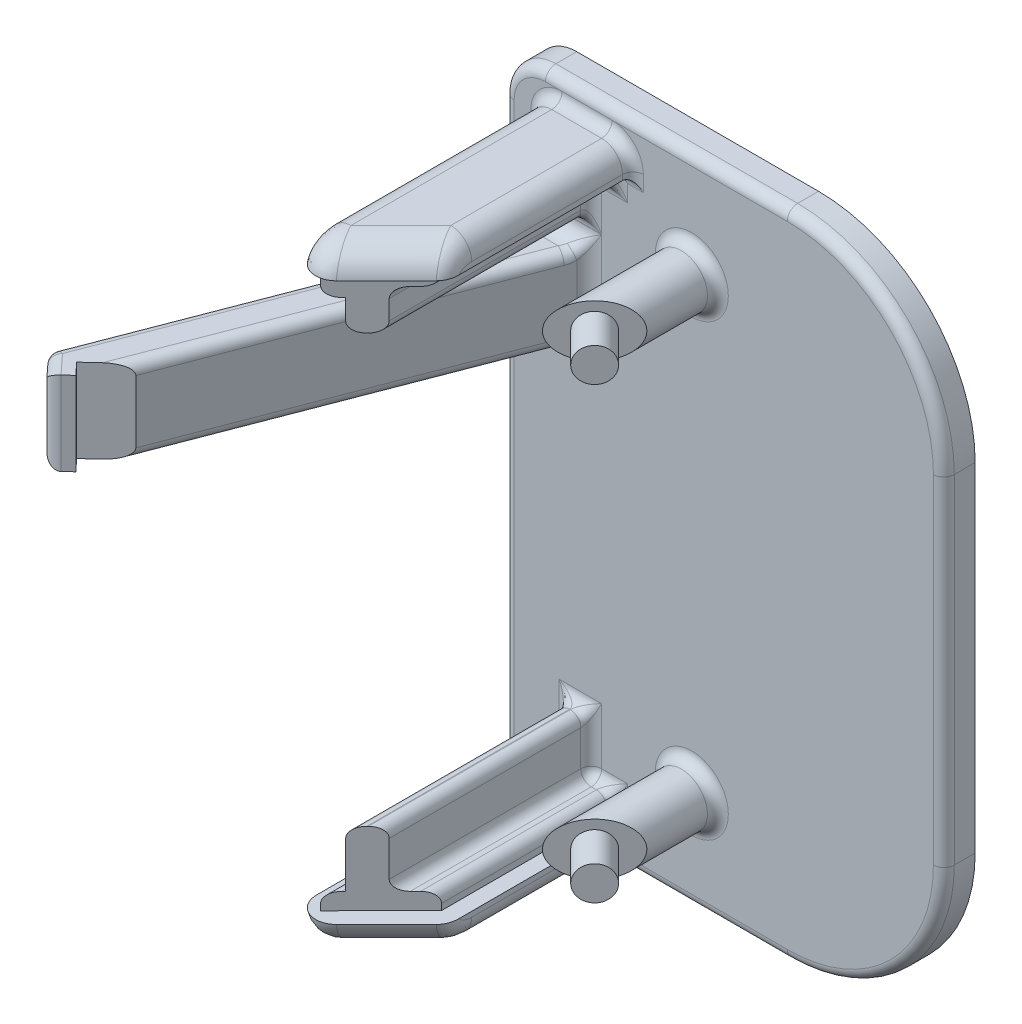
SolidWorks part; units mm, degrees
ref_plane "Front Plane" through (0, 0, 0) normal (0, 0, 1) x (1, 0, 0)
ref_plane "Top Plane" through (0, 0, 0) normal (0, 1, 0) x (1, 0, 0)
ref_plane "Right Plane" through (0, 0, 0) normal (1, 0, 0) x (0, 0, -1)
sketch "Sketch1" plane through (0, 0, 0) normal (0, 0, 1) x (1, 0, 0)
  circle A0 centre (49.5722, 9.7726) radius 2.5
  circle A1 centre (49.5722, 52.7726) radius 2.5
  dimension "D1" = 5
extrude "Boss-Extrude1" add sketch "Sketch1" along normal blind 12
sketch "Sketch2" plane through (0, 5.2784, 0) normal (0, -1, 0) x (1, 0, 0)
  line L1 (26.8033, 32.0723) -> (54.69, 32.0723)
  line L2 (26.8033, 32.0723) -> (52.2592, 6.6165)
  line L3 (26.8033, 32.0723) -> (52.2592, 6.6165)
  line L4 (54.69, 32.0723) -> (52.2592, 6.6165)
  dimension "D1" = 0.3
extrude "Cut-Extrude1" cut sketch "Sketch2" against normal through all
sketch "Sketch3" plane through (29.4378, 0, 29.4378) normal (0.7071, 0, 0.7071) x (0.7071, 0, -0.7071)
  circle A1 centre (28.4743, 9.7726) radius 1.625
  circle A2 centre (28.4743, 52.7726) radius 1.625
  dimension "D1" = 3.25
extrude "Boss-Extrude11" add sketch "Sketch3" along normal blind 4
sketch "Sketch4" plane through (0, 0, 0) normal (0, 0, 1) x (1, 0, 0)
  line L0 (52.4713, 5.2784) -> (52.4713, 57.2784) construction
  line L1 (52.4713, 31.2784) -> (11.8863, 31.2784) construction
  line L2 (34.7559, 5.2784) -> (28.1539, 5.2784) construction
  line L3 (28.1539, 5.2784) -> (27.0155, 5.2784) construction
  line L4 (32.7517, 5.2784) -> (28.1539, 5.2784)
  line L5 (28.1539, 5.2784) -> (27.0155, 5.2784)
  line L6 (32.7517, 6.2784) -> (28.1539, 6.2784)
  line L7 (28.1539, 6.2784) -> (27.442, 6.2784)
  line L8 (28.1539, 3.7784) -> (27.0155, 3.7784)
  line L9 (32.7517, 3.7784) -> (28.1539, 3.7784)
  line L10 (23.4633, 7.3919) -> (26.0211, 7.3919)
  line L11 (24.9889, 7.3919) -> (27.0155, 5.2784) construction
  line L12 (25.7107, 8.084) -> (27.442, 6.2784) construction
  line L14 (32.7517, 6.2784) -> (32.7517, 3.7784)
  line L15 (34.7559, 6.2784) -> (28.1539, 6.2784) construction
  line L16 (34.7559, 3.7784) -> (28.1539, 3.7784) construction
  line L17 (34.7559, 5.2784) -> (28.1539, 5.2784) construction
  ellipse E2 centre (27.0155, 8.2784) end of major axis (27.0155, 5.2784) minor radius 2.1213 (24.8941, 8.2784) -> (27.0155, 5.2784) ccw construction
  ellipse E3 centre (27.0155, 8.2784) end of major axis (27.0155, 5.2784) minor radius 2.1213 (24.9889, 7.3919) -> (27.0155, 5.2784) ccw
  spline S0 degree 2 poles (27.442, 6.2784) (26.2905, 6.2328) (26.0211, 7.3919) knots 0 0 0 1 1 1
  spline S2 degree 1 poles (23.5235, 7.0714) (27.0155, 3.7784) knots 0 0 1 1 construction
  spline S3 degree 3 poles (23.5235, 7.0714) (23.6144, 6.656) (23.8952, 5.8401) (24.6195, 4.7813) (25.6693, 3.989) (26.573, 3.7784) (27.0155, 3.7784) knots -1.270803 -1.270803 -1.270803 -1.270803 -0.953103 -0.635402 -0.317701 0 0 0 0 only from (23.4633, 7.3919) to (27.0155, 3.7784)
  dimension "D1" = 1
  dimension "D2" = 1.5
sketch "Sketch11" plane through (0, 0, 0) normal (0, 0, 1) x (1, 0, 0)
  line L0 (36.6555, 4.8807) -> (42.4348, 4.8807)
  line L1 (37.8555, 6.4807) -> (37.8555, 11.8807)
  line L2 (39.9348, 6.4807) -> (39.9348, 11.8807)
  line L3 (52.4713, 31.2784) -> (11.8863, 31.2784) construction
  line L4 (39.9348, 11.8807) -> (37.8555, 11.8807)
  line L5 (39.9348, 11.8807) -> (39.9348, 60.1878) construction
  line L6 (36.6555, 6.4807) -> (36.6555, 60.9475) construction
  line L7 (37.8555, 6.4807) -> (36.6555, 6.4807)
  line L8 (36.6555, 4.8807) -> (36.6555, 6.4807)
  line L9 (37.8555, 11.8807) -> (37.8555, 60.1878) construction
  line L10 (42.4348, 6.4807) -> (42.4348, 61.454) construction
  line L11 (39.9348, 6.4807) -> (42.4348, 6.4807)
  line L12 (42.4348, 4.8807) -> (42.4348, 6.4807)
  line L13 (36.6555, 58.2559) -> (42.4348, 58.2559)
  line L14 (42.4348, 58.2559) -> (42.4348, 56.6559)
  line L15 (42.4348, 56.6559) -> (39.9348, 56.6559)
  line L16 (39.9348, 56.6559) -> (39.9348, 52.8014)
  line L17 (39.9348, 52.8014) -> (37.8555, 52.8014)
  line L18 (37.8555, 52.8014) -> (37.8555, 55.7559)
  line L19 (37.8555, 55.7559) -> (36.6555, 55.7559)
  line L20 (36.6555, 55.7559) -> (36.6555, 58.2559)
  dimension "D1" = 1.6
  dimension "D2" = 2.5
  dimension "D3" = 1.6
  dimension "D4" = 1.6
  dimension "D5" = 1.2
extrude "Boss-Extrude9" add sketch "Sketch11" along normal blind 23
sketch "Sketch12" plane through (0, 5.2784, 0) normal (0, -1, 0) x (1, 0, 0)
  line L0 (43.1151, 16.1445) -> (35.3217, 23.9883)
  line L1 (35.3217, 23.9883) -> (38.352, 26.0464)
  line L2 (38.352, 26.0464) -> (51.5805, 20.4517)
  line L3 (51.5805, 20.4517) -> (43.1151, 16.1445)
extrude "Cut-Extrude6" cut sketch "Sketch12" against normal up to surface and the other way up to surface
sketch "Sketch13" plane through (0, 0, 0) normal (0, 0, 1) x (1, 0, 0)
  line L0 (42.4348, 6.4807) -> (42.4348, 4.8807) construction
  line L1 (35.1555, 2.3807) -> (35.1555, 4.8807)
  line L2 (43.9348, 4.8807) -> (43.9348, 2.3807)
  line L3 (43.9348, 2.3807) -> (35.1555, 2.3807)
  line L4 (35.1555, 4.8807) -> (43.9348, 4.8807)
  line L6 (52.4713, 31.2784) -> (11.8863, 31.2784) construction
  line L7 (52.4713, 5.2784) -> (52.4713, 57.2784) construction
  line L8 (43.9348, 58.2717) -> (43.9348, 60.7717)
  line L9 (43.9348, 60.7717) -> (35.1555, 60.7717)
  line L10 (43.9348, 58.2717) -> (35.1555, 58.2717)
  line L11 (35.1555, 58.2717) -> (35.1555, 60.7717)
  dimension "D1" = 2.5
  dimension "D2" = 2.5
  dimension "D3" = 1.5
extrude "Boss-Extrude10" add sketch "Sketch13" along normal blind 27
sketch "Sketch14" plane through (0, 5.2784, 0) normal (0, 1, 0) x (1, 0, 0)
  line L0 (45.0913, -16.4713) -> (34.4268, -27.15)
  line L1 (34.4268, -27.15) -> (42.7839, -30.8366)
  line L2 (42.7839, -30.8366) -> (51.6362, -30.1219)
  line L3 (51.6362, -30.1219) -> (53.9172, -23.7765)
  line L4 (53.9172, -23.7765) -> (45.0913, -16.4713)
extrude "Cut-Extrude7" cut sketch "Sketch14" against normal blind 26 and the other way through all
fillet "Fillet1" radius 3 1 edges at (39.5452, 2.3807, 22.0248)
fillet "Fillet2" radius 2 4 edges at (43.9348, 3.0894, 16.1837) (35.1555, 2.3807, 11.1171) (43.9348, 2.3807, 6.7216) (35.1555, 3.0894, 24.9746)
ref_plane "Plane1" through (0, 31.2784, 0) normal (0, 1, 0) x (0, 0, 1)
fillet "Fillet3" radius 3 1 edges at (39.5452, 60.7717, 22.0248)
fillet "Fillet4" radius 2 4 edges at (35.1555, 60.063, 24.9746) (43.9348, 60.063, 16.1837) (35.1555, 60.7717, 11.1171) (43.9348, 60.7717, 6.7216)
sketch "Sketch15" plane through (0, 0, 0) normal (0, 0, 1) x (1, 0, 0)
  line L0 (37.1555, 60.7717) -> (41.9348, 60.7717) construction
  line L1 (31.5543, 62.7717) -> (73.7149, 62.7717)
  line L2 (31.5543, 62.7717) -> (31.5543, 0.3807)
  line L3 (31.5543, 0.3807) -> (73.7149, 0.3807)
  line L4 (73.7149, 62.7717) -> (73.7149, 0.3807)
  line L5 (41.9348, 2.3807) -> (37.1555, 2.3807) construction
  dimension "D1" = 2
  dimension "D2" = 2
extrude "Boss-Extrude12" add sketch "Sketch15" against normal blind 3
fillet "Fillet5" radius 1 34 edges at (43.9348, 58.5217, 0) (43.3491, 60.1859, 0) (39.5452, 60.7717, 0) (35.7413, 60.1859, 0) (35.1555, 58.5217, 0) (39.5452, 58.2717, 0) (37.8555, 54.2787, 0) (38.8952, 52.8014, 0) (39.9348, 54.7287, 0) (41.1848, 56.6559, 0) (42.4348, 57.4559, 0) (39.5452, 58.2559, 0) (36.6555, 57.0059, 0) (37.2555, 55.7559, 0) (41.1848, 6.4807, 0) (39.9348, 9.1807, 0) (38.8952, 11.8807, 0) (37.8555, 9.1807, 0) (37.2555, 6.4807, 0) (35.1555, 4.6307, 0) (35.7413, 2.9664, 0) (39.5452, 2.3807, 0) (43.3491, 2.9664, 0) (43.9348, 4.6307, 0) (52.6346, 62.7717, 0) (73.7149, 31.5762, 0) (52.6346, 0.3807, 0) (31.5543, 31.5762, 0) (52.0722, 9.7726, 0) (52.0722, 52.7726, 0)
sketch "Sketch16" plane through (0, 0, 0) normal (0, 0, 1) x (1, 0, 0)
  line L0 (312.859, 85.3333) -> (312.859, 426.6667) construction
  line L1 (62.5608, 29.675) -> (62.5608, 31.1627) construction
  line L2 (61.7928, 30.4188) -> (63.2926, 30.4188) construction
  line L3 (62.5608, 25.9828) -> (70.3387, 25.9828)
  line L4 (66.4498, 27.9433) -> (70.3568, 27.9433)
  line L5 (66.4498, 27.9433) -> (68.5103, 29.7833)
  line L6 (65.0779, 34.3387) -> (70.3568, 34.3387)
  line L7 (70.3568, 27.9433) -> (70.3568, 32.5408) construction
  line L8 (66.4643, 32.5408) -> (70.3568, 32.5408)
  line L9 (70.3568, 30.2421) -> (71.0775, 30.2421) construction
  line L10 (68.4297, 30.7607) -> (66.4643, 32.5408)
  circle A0 centre (62.5608, 30.4188) radius 0.7318
  arc A1 (60.8747, 31.758) -> (64.0861, 31.9387) centre (62.5608, 30.4188) ccw
  arc A2 (58.9245, 32.9596) -> (62.5608, 25.9828) centre (62.5608, 30.4188) ccw
  spline S0 degree 3 poles (60.812, 31.675) (61.2115, 32.1405) (60.8075, 33.725) (59.2728, 33.419) (58.9245, 32.9596) knots 0 0 0 0 0.502783 1 1 1 1
  spline S1 degree 3 poles (70.3387, 25.9828) (70.8165, 26.026) (71.462, 26.9742) (70.8039, 27.8735) (70.3568, 27.9433) knots 0 0 0 0 0.510068 1 1 1 1
  spline S2 degree 2 poles (68.5103, 29.7833) (68.9741, 30.2552) (68.4297, 30.7607) knots 0 0 0 1 1 1
  spline S3 degree 3 poles (64.0861, 31.9387) (63.8582, 32.2965) (63.5699, 33.4196) (64.531, 34.2166) (65.0779, 34.3387) knots 0 0 0 0 0.42958 1 1 1 1
  spline S4 degree 3 poles (70.3568, 32.5408) (70.6394, 32.565) (71.041, 32.8626) (71.188, 33.5143) (70.9761, 34.1013) (70.5887, 34.3348) (70.3568, 34.3387) knots 0 0 0 0 0.321053 0.517682 0.738255 1 1 1 1
fillet "Fillet6" radius 15 4 edges at (73.422, 0.6735, -0.2929) (73.422, 62.4788, -0.2929) (73.7149, 62.7717, -2) (73.7149, 0.3807, -2)
fillet "Fillet7" radius 4 4 edges at (31.8472, 62.4788, -0.2929) (31.8472, 0.6735, -0.2929) (31.5543, 0.3807, -2) (31.5543, 62.7717, -2)
fillet "Fillet8" radius 1 10 edges at (36.3626, 6.7735, 0.2929) (37.5626, 12.1735, 0.2929) (40.2277, 12.1735, 0.2929) (40.2277, 6.7735, 0.2929) (42.7277, 6.7735, 0.2929) (36.6555, 6.4807, 11.8229) (37.8555, 11.8807, 11.219) (39.9348, 11.8807, 10.1727) (39.9348, 6.4807, 10.1727) (42.4348, 6.4807, 8.9146)
fillet "Fillet9" radius 1 10 edges at (42.7277, 56.363, 0.2929) (40.2277, 56.363, 0.2929) (40.2277, 52.5085, 0.2929) (37.5626, 52.5085, 0.2929) (36.3626, 55.463, 0.2929) (42.4348, 56.6559, 8.9146) (39.9348, 56.6559, 10.1727) (39.9348, 52.8014, 10.1727) (37.8555, 52.8014, 11.219) (36.6555, 55.7559, 11.8229)
ref_plane "Plane2" through (0, 42.2784, 0) normal (0, 1, 0) x (0, 0, 1)
sketch "Sketch17" plane through (0, 42.2784, 0) normal (0, 1, 0) x (0, 0, 1)
  line L0 (31.4893, 27.8106) -> (0, 39.8999)
  line L1 (0, 36.8555) -> (0, 40.9348) construction
  line L3 (35.3521, 25.9175) -> (36.7081, 24.4474)
  line L4 (36.7081, 24.4474) -> (34.401, 22.3196)
  line L5 (0, 39.8999) -> (0, 35.5268)
  line L6 (0, 35.5268) -> (34.401, 22.3196)
  line L7 (31.4893, 27.8106) -> (34.2083, 24.8626)
  line L8 (34.2083, 24.8626) -> (35.3521, 25.9175)
  dimension "D2" = 2
extrude "Boss-Extrude13" add sketch "Sketch17" along normal blind 8
fillet "Fillet10" radius 5 1 edges at (35.5268, 46.2784, 0)
fillet "Fillet12" radius 1.5 5 edges at (32.2195, 42.2784, -0.0577) (32.2195, 50.2784, -0.0577) (39.8999, 46.2784, 0) (36.2271, 42.2784, 0) (36.2271, 50.2784, 0)
fillet "Fillet14" radius 1 16 edges at (40.0812, 50.9288, 0.2638) (39.429, 50.3035, 1.2266) (40.0812, 41.628, 0.2638) (39.429, 42.2533, 1.2266) (33.6998, 51.8298, 2.8316) (33.7641, 50.2784, 3.4572) (24.4474, 46.2784, 36.7081) (23.3835, 50.2784, 35.5545) (23.3835, 42.2784, 35.5545) (33.5673, 50.2784, 16.4947) (33.5673, 42.2784, 16.4947) (27.8777, 50.2784, 19.9237) (22.3196, 46.2784, 34.401) (33.7641, 42.2784, 3.4572) (27.8777, 42.2784, 19.9237)
